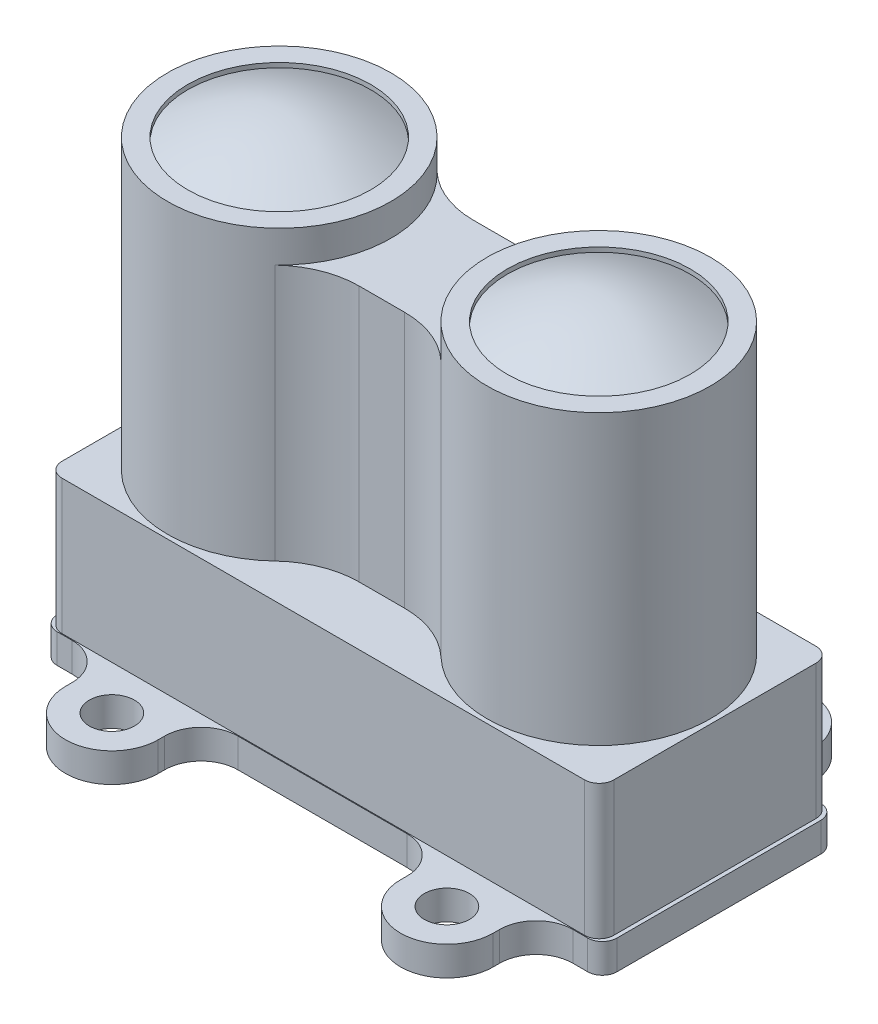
SolidWorks part; units mm, degrees
ref_plane "Front Plane" through (0, 0, 0) normal (0, 0, 1) x (1, 0, 0)
ref_plane "Top Plane" through (0, 0, 0) normal (0, 1, 0) x (1, 0, 0)
ref_plane "Right Plane" through (0, 0, 0) normal (1, 0, 0) x (0, 0, -1)
imported_body "Imported3"
sketch "Sketch1" plane through (0, 0, 13.8557) normal (0, 0, 1) x (1, 0, 0)
  line L0 (10.5219, 0) -> (-10.5219, 0)
  line L1 (-10.5219, 0) -> (-10.5219, -2.54)
  line L2 (-10.5219, -2.54) -> (10.5219, -2.54)
  line L3 (10.5219, -2.54) -> (10.5219, 0)
extrude "Cut-Extrude1" cut sketch "Sketch1" against normal blind 3.7401
sketch "Sketch2" plane through (-18.5611, 0, 0) normal (-1, 0, 0) x (0, 0, 1)
  line L0 (-13.8557, 0) -> (-10.0457, 0)
  line L1 (-10.0457, 0) -> (-10.0457, 11.684)
  line L2 (-10.0457, 11.684) -> (0, 11.684)
  line L3 (0, 11.684) -> (13.8557, 11.684)
  line L4 (13.8557, 11.684) -> (13.8557, 0)
  line L5 (13.8557, 0) -> (10.1156, 0)
  line L6 (10.1156, 0) -> (10.1156, -2.54)
  line L7 (10.1156, -2.54) -> (-13.8557, -2.54)
  line L8 (-13.8557, -2.54) -> (-13.8557, 0)
extrude "Boss-Extrude1" add sketch "Sketch2" along normal blind 4.9974
sketch "Sketch3" plane through (18.5611, 0, 0) normal (1, 0, 0) x (0, 0, -1)
  line L0 (10.0457, 0) -> (13.8557, 0)
  line L1 (13.8557, 0) -> (13.8557, -2.54)
  line L2 (13.8557, -2.54) -> (-10.1156, -2.54)
  line L3 (-10.1156, -2.54) -> (-10.1156, 0)
  line L4 (-10.1156, 0) -> (-13.8557, 0)
  line L5 (-13.8557, 0) -> (-13.8557, 11.684)
  line L6 (-13.8557, 11.684) -> (0, 11.684)
  line L7 (0, 11.684) -> (10.0457, 11.684)
  line L8 (10.0457, 11.684) -> (10.0457, 0)
extrude "Boss-Extrude2" add sketch "Sketch3" along normal blind 4.9974
sketch "Sketch4" plane through (-23.5585, 0, 0) normal (-1, 0, 0) x (0, 0, 1)
  line L0 (-13.8557, 0) -> (-10.0457, 0)
  line L1 (-10.0457, 0) -> (-10.0457, 11.684)
  line L2 (-10.0457, 11.684) -> (13.8557, 11.684)
  line L3 (13.8557, 11.684) -> (13.8557, 0)
  line L4 (13.8557, 0) -> (10.1156, 0)
  line L5 (10.1156, 0) -> (10.1156, -2.54)
  line L6 (10.1156, -2.54) -> (-13.8557, -2.54)
  line L7 (-13.8557, -2.54) -> (-13.8557, 0)
extrude "Boss-Extrude3" add sketch "Sketch4" along normal blind 0.7366
sketch "Sketch5" plane through (23.5585, 0, 0) normal (1, 0, 0) x (0, 0, -1)
  line L0 (10.0457, 0) -> (13.8557, 0)
  line L1 (13.8557, 0) -> (13.8557, -2.54)
  line L2 (13.8557, -2.54) -> (-10.1156, -2.54)
  line L3 (-10.1156, -2.54) -> (-10.1156, 0)
  line L4 (-10.1156, 0) -> (-13.8557, 0)
  line L5 (-13.8557, 0) -> (-13.8557, 11.684)
  line L6 (-13.8557, 11.684) -> (10.0457, 11.684)
  line L7 (10.0457, 11.684) -> (10.0457, 0)
extrude "Boss-Extrude4" add sketch "Sketch5" along normal blind 0.7366
sketch "Sketch6" plane through (0, 0, -13.8557) normal (0, 0, -1) x (-1, 0, 0)
  line L0 (10.522, 0) -> (-10.5219, 0)
  line L1 (-10.5219, 0) -> (-10.5219, -2.54)
  line L2 (-10.5219, -2.54) -> (10.522, -2.54)
  line L3 (10.522, -2.54) -> (10.522, 0)
extrude "Cut-Extrude2" cut sketch "Sketch6" against normal blind 3.7402
sketch "Sketch7" plane through (24.2951, 0, 0) normal (1, 0, 0) x (0, 0, -1)
  line L0 (-10.1156, 0) -> (10.0457, 0)
  line L1 (10.0457, 0) -> (10.0457, 11.684)
  line L2 (10.0457, 11.684) -> (-13.8557, 11.684)
  line L3 (-13.8557, 11.684) -> (-13.8557, 0)
  line L4 (-13.8557, 0) -> (-10.1156, 0)
extrude "Cut-Extrude3" cut sketch "Sketch7" against normal blind 0.3429
sketch "Sketch8" plane through (-24.2951, 0, 0) normal (-1, 0, 0) x (0, 0, 1)
  line L0 (-10.0457, 0) -> (10.1156, 0)
  line L1 (10.1156, 0) -> (13.8557, 0)
  line L2 (13.8557, 0) -> (13.8557, 11.684)
  line L3 (13.8557, 11.684) -> (-10.0457, 11.684)
  line L4 (-10.0457, 11.684) -> (-10.0457, 0)
extrude "Cut-Extrude4" cut sketch "Sketch8" against normal blind 0.3429
sketch "Sketch9" plane through (0, 0, -13.8557) normal (0, 0, -1) x (-1, 0, 0)
  line L0 (24.2951, 0) -> (18.5611, 0)
  line L1 (18.5611, 0) -> (18.5611, -2.54)
  line L2 (18.5611, -2.54) -> (24.2951, -2.54)
  line L3 (24.2951, -2.54) -> (24.2951, 0)
extrude "Cut-Extrude5" cut sketch "Sketch9" against normal blind 3.7402
sketch "Sketch10" plane through (0, 0, -13.8557) normal (0, 0, -1) x (-1, 0, 0)
  line L0 (-18.5611, 0) -> (-24.2951, 0)
  line L1 (-24.2951, 0) -> (-24.2951, -2.54)
  line L2 (-24.2951, -2.54) -> (-18.5611, -2.54)
  line L3 (-18.5611, -2.54) -> (-18.5611, 0)
extrude "Cut-Extrude6" cut sketch "Sketch10" against normal blind 3.7402
sketch "Sketch11" plane through (0, 0, 13.8557) normal (0, 0, 1) x (1, 0, 0)
  line L0 (-23.9522, 0) -> (23.9522, 0)
  line L1 (23.9522, 0) -> (23.9522, 11.684)
  line L2 (23.9522, 11.684) -> (-23.9522, 11.684)
  line L3 (-23.9522, 11.684) -> (-23.9522, 0)
extrude "Cut-Extrude7" cut sketch "Sketch11" against normal blind 3.81
hole_wizard "#23 (0.154) Diameter Hole1" positions "Sketch13" profile "Sketch12" hole size "#23" standard "ANSI Inch"
sketch "Sketch13" plane through (0, 0, 0) normal (0, 1, 0) x (1, 0, 0)
  point P0 (-14.5415, -13.8557)
  point P1 (14.5415, 13.8557)
  point P2 (-14.5415, 13.8557)
  point P3 (14.5415, -13.8557)
sketch "Sketch12" plane through (-14.5415, 0, 13.8557) normal (1, 0, 0) x (0, 0, 1)
  line L0 (0, 0) -> (0, 2.54)
  line L1 (0, 2.54) -> (1.9558, 2.54)
  line L2 (1.9558, 2.54) -> (1.9558, 0)
  line L5 (1.9558, 0) -> (0, 0)
  line L11 (0, -6.35) -> (0, 107.95) construction
  dimension "Thru Hole Dia." = 3.9116
  dimension "Thru Hole Depth" = 2.54
ref_plane "Plane1" through (0, 0, 0) normal (0, 0, -1) x (-1, 0, 0)
sketch "Sketch14" plane through (0, 0, 0) normal (0, 0, -1) x (-1, 0, 0)
  line L0 (4.1783, 33.9344) -> (-4.1783, 33.9344)
rib "Rib1" sketch "Sketch14" sketch "Sketch14" thickness 9.906 extrusion direction parallel to sketch draft on no parameters "D1"=9.906
fillet "Fillet1" radius 1.27 8 edges at (-24.2951, -1.27, -10.1156) (-24.2951, -1.27, 10.1156) (24.2951, -1.27, -10.1156) (23.9522, 5.842, -10.0457) (24.2951, -1.27, 10.1156) (-23.9522, 5.842, -10.0457) (23.9522, 5.842, 10.0457) (-23.9522, 5.842, 10.0457)
fillet "Fillet2" radius 3.175 8 edges at (-18.5611, -1.27, -10.1156) (-18.561, -1.27, 10.1156) (10.5219, -1.27, 10.1156) (-10.5219, -1.27, 10.1156) (10.5219, -1.27, -10.1156) (18.5611, -1.27, 10.1156) (18.5611, -1.27, -10.1156) (-10.522, -1.27, -10.1156)
fillet "Fillet3" radius 7.62 4 edges at (-5.5398, 22.8092, -4.953) (5.5398, 22.8092, -4.953) (-5.5398, 22.8092, 4.953) (5.5398, 22.8092, 4.953)
sketch "Sketch15" plane through (0, 11.684, 0) normal (0, 1, 0) x (1, 0, 0)
  line L0 (-4.3688, 13.4239) -> (-4.3688, 10.0457)
  line L1 (-4.3688, 13.4239) -> (4.3688, 13.4239) construction
  line L2 (-4.3688, 13.4239) -> (-4.3688, 10.0457) construction
  line L3 (22.6822, 10.0457) -> (-22.6822, 10.0457) construction
  line L4 (-4.3688, 10.0457) -> (4.3688, 10.0457)
  line L5 (4.3688, 10.0457) -> (4.3688, 13.4239) construction
  line L6 (4.3688, 10.0457) -> (4.3688, 13.4239)
  line L7 (4.3688, 13.4239) -> (4.9112, 25.4442)
  line L8 (4.9112, 25.4442) -> (37.3939, 39.4212)
  line L9 (37.3939, 39.4212) -> (43.1794, 33.9899)
  line L10 (43.1794, 33.9899) -> (53.0973, 35.9971)
  line L11 (53.0973, 35.9971) -> (49.3769, 54.3801)
  line L12 (49.3769, 54.3801) -> (27.9582, 55.3466)
  line L13 (27.9582, 55.3466) -> (26.7675, 55.3466)
  line L14 (26.7675, 55.3466) -> (-10.0706, 27.7322)
  line L15 (-10.0706, 27.7322) -> (-4.3688, 13.4239)
extrude "Cut-Extrude8" cut sketch "Sketch15" against normal blind 7.62
